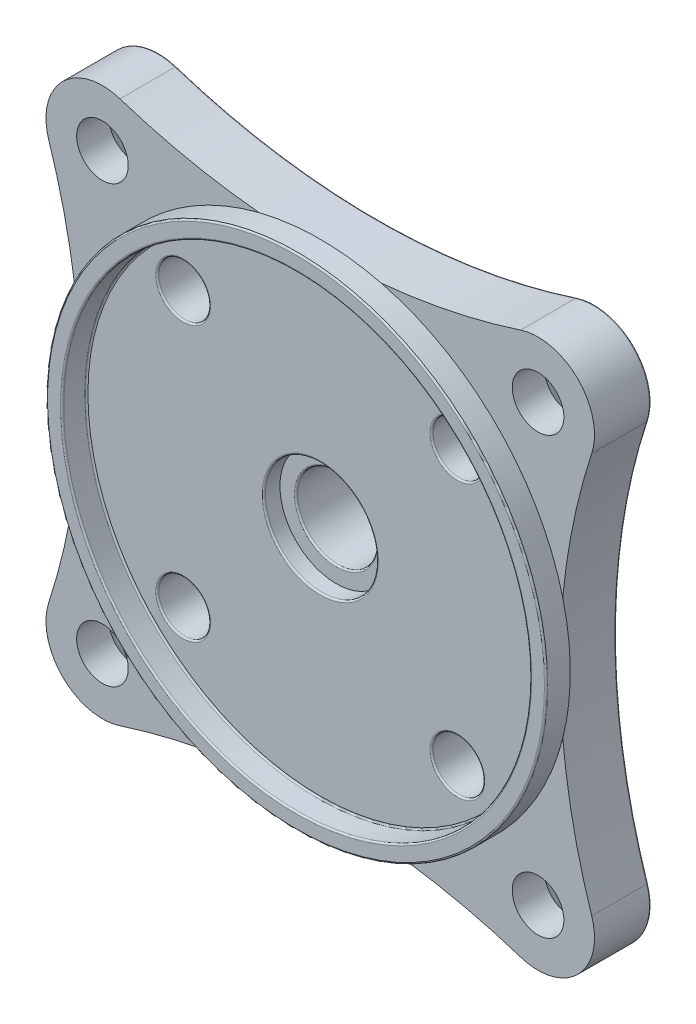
SolidWorks part; units mm, degrees
ref_plane "Plan1" through (0, 0, 0) normal (0, 0, 1) x (1, 0, 0)
ref_plane "Plan2" through (0, 0, 0) normal (0, 1, 0) x (1, 0, 0)
ref_plane "Plan3" through (0, 0, 0) normal (1, 0, 0) x (0, 0, -1)
sketch "Esquisse1" plane through (0, 0, 0) normal (0, 0, 1) x (1, 0, 0)
  line L0 (0, 0) -> (0, 184.1018) construction
  line L1 (-26.5, -118.6434) -> (-26.5, 184.1018) construction
  line L2 (0, 0) -> (-36.3365, 0) construction
  line L3 (-14.8521, 0) -> (0, 0)
  line L4 (0, 0) -> (0, 14.8521)
  arc A0 (-12.4138, 16.8272) -> (-16.8272, 12.4138) centre (-13.5, 13.5) ccw
  arc A1 (-14.8521, 0) -> (-16.8272, 12.4138) centre (-54.8521, 0) ccw
  arc A2 (-12.4138, 16.8272) -> (0, 14.8521) centre (0, 54.8521) ccw
  dimension "D2" = 13.5
  dimension "D3" = 7
  dimension "D5" = 80
  dimension "D6" = 80
  dimension "D1" = 26.5
  dimension "D4" = 13.5
extrude "Extrusion1" add sketch "Esquisse1" along normal blind 3.5
pattern_circular "Répétition circulaire1" count 4 over 360
sketch "Esquisse3" plane through (0, 0, 0) normal (0, 0, -1) x (-1, 0, 0)
  line L0 (-13.5, 13.5) -> (13.5, -13.5) construction
  line L1 (13.5, 13.5) -> (-13.5, -13.5) construction
  circle A0 centre (13.5, 13.5) radius 1.6
  circle A1 centre (13.5, -13.5) radius 1.6
  circle A2 centre (-13.5, -13.5) radius 1.6
  circle A3 centre (-13.5, 13.5) radius 1.6
  circle A4 centre (-8.5, 8.5) radius 1.6
  circle A5 centre (8.5, 8.5) radius 1.6
  circle A6 centre (8.5, -8.5) radius 1.6
  circle A7 centre (-8.5, -8.5) radius 1.6
  dimension "D1" = 3.2
  dimension "D2" = 3.2
  dimension "D3" = 3.2
  dimension "D4" = 3.2
  dimension "D5" = 3.2
  dimension "D6" = 3.2
  dimension "D7" = 3.2
  dimension "D8" = 3.2
  dimension "D9" = 17
  dimension "D10" = 17
  dimension "D11" = 8.5
  dimension "D12" = 8.5
extrude "Enlèv. mat.-Extru.3" cut sketch "Esquisse3" against normal through all
chamfer "Chanfrein3" distance 1.5 angle 45
sketch "Esquisse4" plane through (0, 0, 0) normal (0, 0, -1) x (-1, 0, 0)
  arc A24 (5.5523, 11.2039) -> (11.2039, 5.5523) centre (8.5, 8.5) ccw
  arc A25 (11.2039, -5.5523) -> (5.5523, -11.2039) centre (8.5, -8.5) ccw
  arc A26 (-5.5523, -11.2039) -> (-11.2039, -5.5523) centre (-8.5, -8.5) ccw
  arc A27 (-11.2039, 5.5523) -> (-5.5523, 11.2039) centre (-8.5, 8.5) ccw
  arc A28 (5.5523, -11.2039) -> (-5.5523, -11.2039) centre (0, -54.8521) ccw
  arc A29 (11.2039, 5.5523) -> (11.2039, -5.5523) centre (54.8521, 0) ccw
  arc A30 (-11.2039, -5.5523) -> (-11.2039, 5.5523) centre (-54.8521, 0) ccw
  arc A32 (-12.7356, 12.7356) -> (12.7356, 12.7356) centre (0, 54.8521) ccw
  arc A33 (-12.7356, -12.7356) -> (-12.7356, 12.7356) centre (-54.8521, 0) ccw
  arc A34 (12.7356, -12.7356) -> (-12.7356, -12.7356) centre (0, -54.8521) ccw
  arc A35 (12.7356, 12.7356) -> (12.7356, -12.7356) centre (54.8521, 0) ccw
  arc A36 (-5.5523, 11.2039) -> (5.5523, 11.2039) centre (0, 54.8521) ccw
  dimension "D2" = 8
  dimension "D3" = 8
  dimension "D4" = 8
  dimension "D5" = 8
  dimension "D1" = 4
extrude "Extrusion2" add sketch "Esquisse4" along normal blind 1.5
sketch "Esquisse5" plane through (0, 0, -1.5) normal (0, 0, -1) x (-1, 0, 0)
  circle A0 centre (0, 0) radius 6.5
  dimension "D1" = 13
extrude "Extrusion3" add sketch "Esquisse5" along normal blind 0.75
sketch "Esquisse6" plane through (0, 0, -2.25) normal (0, 0, -1) x (-1, 0, 0)
  circle A0 centre (0, 0) radius 3.5
  dimension "D1" = 7
extrude "Extrusion4" add sketch "Esquisse6" along normal blind 6
sketch "Esquisse7" plane through (0, 0, -8.25) normal (0, 0, -1) x (-1, 0, 0)
  circle A0 centre (0, 0) radius 2.5
  dimension "D1" = 5
extrude "Enlèv. mat.-Extru.4" cut sketch "Esquisse7" against normal through all
sketch "Esquisse8" plane through (0, 0, 3.5) normal (0, 0, 1) x (1, 0, 0)
  circle A0 centre (0, 0) radius 15.5
  circle A1 centre (0, 0) radius 14.5
  dimension "D1" = 31
  dimension "D2" = 29
extrude "Extrusion5" add sketch "Esquisse8" along normal blind 1.5
sketch "Esquisse9" plane through (0, 0, 3.5) normal (0, 0, 1) x (1, 0, 0)
  circle A0 centre (0, 0) radius 3.5
  dimension "D1" = 7
extrude "Enlèv. mat.-Extru.5" cut sketch "Esquisse9" against normal blind 1
fillet "Congé2" radius 0.1
